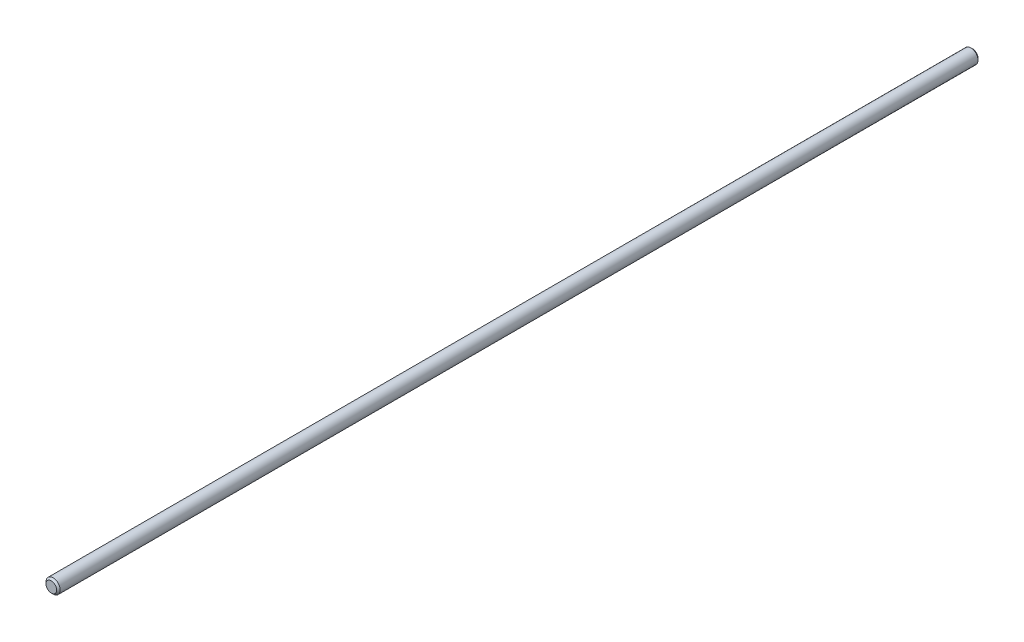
SolidWorks part; units mm, degrees
ref_plane "前视基准面" through (0, 0, 0) normal (0, 0, 1) x (1, 0, 0)
ref_plane "上视基准面" through (0, 0, 0) normal (0, 1, 0) x (1, 0, 0)
ref_plane "右视基准面" through (0, 0, 0) normal (1, 0, 0) x (0, 0, -1)
sketch "草图1" plane through (0, 0, 0) normal (0, 0, 1) x (1, 0, 0)
  circle A0 centre (0, 0) radius 2
extrude "凸台-拉伸1" add sketch "草图1" against normal blind 260
chamfer "倒角1" distance 0.5 angle 45 2 edges at (2, 0, -260) (2, 0, 0)
